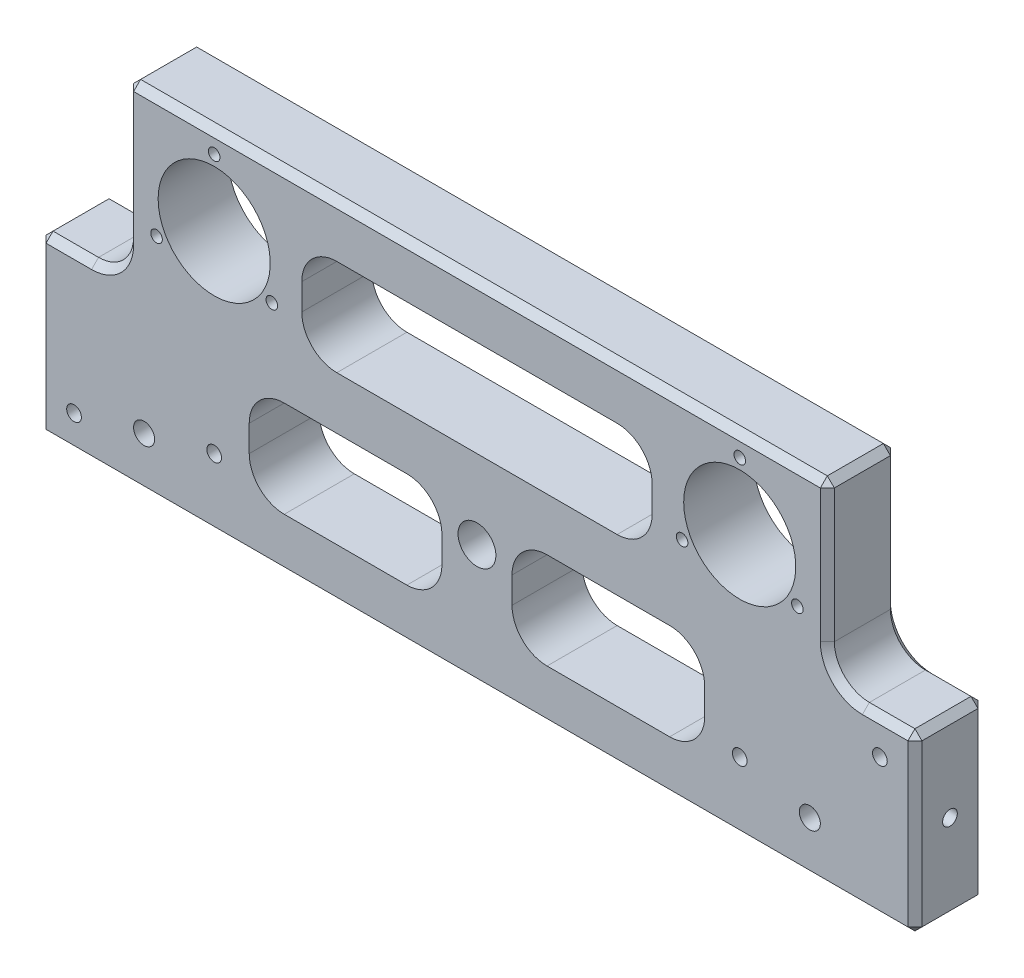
SolidWorks part; units mm, degrees
ref_plane "Plan de face" through (0, 0, 0) normal (0, 0, 1) x (1, 0, 0)
ref_plane "Plan de dessus" through (0, 0, 0) normal (0, 1, 0) x (1, 0, 0)
ref_plane "Plan de droite" through (0, 0, 0) normal (1, 0, 0) x (0, 0, -1)
ref_plane "Plan1" through (0, 0, 20) normal (0, 0, 1) x (1, 0, 0)
sketch "Esquisse1" plane through (0, 0, 20) normal (0, 0, 1) x (1, 0, 0)
  line L0 (125, 50) -> (-125, 50)
  line L1 (-125, 50) -> (-125, -50)
  line L2 (-125, -50) -> (125, -50)
  line L3 (125, -50) -> (125, 50)
extrude "Boss.-Extru.1" add sketch "Esquisse1" against normal blind 20
sketch "Esquisse2" plane through (0, 0, 0) normal (0, 0, -1) x (-1, 0, 0)
  line L0 (100, 0) -> (125, 0)
  line L1 (125, 0) -> (125, 50)
  line L2 (125, 50) -> (100, 50)
  line L3 (100, 50) -> (100, 0)
extrude "Enlèv. mat.-Extru.1" cut sketch "Esquisse2" against normal through all
sketch "Esquisse3" plane through (0, 0, 0) normal (0, 0, -1) x (-1, 0, 0)
  line L0 (-125, 0) -> (-100, 0)
  line L1 (-100, 0) -> (-100, 50)
  line L2 (-100, 50) -> (-125, 50)
  line L3 (-125, 50) -> (-125, 0)
extrude "Enlèv. mat.-Extru.2" cut sketch "Esquisse3" against normal through all
sketch "Esquisse4" plane through (0, 0, 20) normal (0, 0, 1) x (1, 0, 0)
  line L0 (50, 7.5) -> (50, 35)
  line L1 (50, 35) -> (-50, 35)
  line L2 (-50, 35) -> (-50, 7.5)
  line L3 (-50, 7.5) -> (50, 7.5)
extrude "Enlèv. mat.-Extru.3" cut sketch "Esquisse4" against normal through all
sketch "Esquisse5" plane through (0, 0, 20) normal (0, 0, 1) x (1, 0, 0)
  line L0 (-10, -35) -> (-10, -7.5)
  line L1 (-10, -7.5) -> (-65, -7.5)
  line L2 (-65, -7.5) -> (-65, -35)
  line L3 (-65, -35) -> (-10, -35)
extrude "Enlèv. mat.-Extru.4" cut sketch "Esquisse5" against normal through all
sketch "Esquisse6" plane through (0, 0, 20) normal (0, 0, 1) x (1, 0, 0)
  line L0 (10, -7.5) -> (10, -35)
  line L1 (10, -35) -> (65, -35)
  line L2 (65, -35) -> (65, -7.5)
  line L3 (65, -7.5) -> (10, -7.5)
extrude "Enlèv. mat.-Extru.5" cut sketch "Esquisse6" against normal through all
hole_wizard "Dégagement M271" positions "Esquisse8" profile "Esquisse7" hole size "M27" standard "Ansi Metric"
sketch "Esquisse8" plane through (0, 0, 0) normal (0, 0, -1) x (-1, 0, 0)
  point P0 (75, 25)
  point P1 (-75, 25)
sketch "Esquisse7" plane through (-75, 25, 0) normal (1, 0, 0) x (0, 1, 0)
  line L0 (0, 0) -> (0, 20)
  line L1 (0, 20) -> (16, 20)
  line L2 (16, 20) -> (16, 0)
  line L5 (16, 0) -> (0, 0)
  line L11 (0, -6.35) -> (0, 107.95) construction
  dimension "Diamètre du perçage jusqu'au prochain" = 32
  dimension "Profondeur du perçage jusqu'au prochain" = 20
hole_wizard "Trou taraudé M5x0.85" positions "Esquisse10" profile "Esquisse9" tap size "M5x0.8" standard "Ansi Metric"
sketch "Esquisse10" plane through (0, 0, 0) normal (0, 0, -1) x (-1, 0, 0)
  point P0 (75, -30)
  point P1 (-75, -30)
sketch "Esquisse9" plane through (-75, -30, 0) normal (1, 0, 0) x (0, 1, 0)
  line L0 (0, 0) -> (0, 20)
  line L1 (0, 20) -> (2.1, 20)
  line L2 (2.1, 20) -> (2.1, 0)
  line L5 (2.1, 0) -> (0, 0)
  line L11 (0, -6.35) -> (0, 107.95) construction
  dimension "Diamètre du trou pour taraudage jusqu'au prochain" = 4.2
  dimension "Profondeur du trou pour taraudage jusqu'au prochain" = 20
hole_wizard "Trou taraudé M12x1.251" positions "Esquisse12" profile "Esquisse11" tap size "M12x1.25" standard "Ansi Metric"
sketch "Esquisse12" plane through (0, 0, 0) normal (0, 0, -1) x (-1, 0, 0)
  point P0 (0, -15)
sketch "Esquisse11" plane through (0, -15, 0) normal (1, 0, 0) x (0, 1, 0)
  line L0 (0, 0) -> (0, 20)
  line L1 (0, 20) -> (5.4, 20)
  line L2 (5.4, 20) -> (5.4, 0)
  line L5 (5.4, 0) -> (0, 0)
  line L11 (0, -6.35) -> (0, 107.95) construction
  dimension "Diamètre du trou pour taraudage jusqu'au prochain" = 10.8
  dimension "Profondeur du trou pour taraudage jusqu'au prochain" = 20
hole_wizard "Trou taraudé M4x0.71" positions "Esquisse14" profile "Esquisse13" tap size "M4x0.7" standard "Ansi Metric"
sketch "Esquisse14" plane through (0, 0, 0) normal (0, 0, -1) x (-1, 0, 0)
  point P0 (91.4545, 15.5)
  point P1 (75, 44)
  point P2 (58.5455, 15.5)
  point P3 (-75, 44)
  point P4 (-91.4545, 15.5)
  point P5 (-58.5455, 15.5)
sketch "Esquisse13" plane through (-91.4545, 15.5, 0) normal (1, 0, 0) x (0, 1, 0)
  line L0 (0, 0) -> (0, 20)
  line L1 (0, 20) -> (1.65, 20)
  line L2 (1.65, 20) -> (1.65, 0)
  line L5 (1.65, 0) -> (0, 0)
  line L11 (0, -6.35) -> (0, 107.95) construction
  dimension "Diamètre du trou pour taraudage jusqu'au prochain" = 3.3
  dimension "Profondeur du trou pour taraudage jusqu'au prochain" = 20
hole_wizard "Trou taraudé M5x0.84" positions "Esquisse16" profile "Esquisse15" tap size "M5x0.8" standard "Ansi Metric"
sketch "Esquisse16" plane through (0, 0, 20) normal (0, 0, 1) x (1, 0, 0)
  point P0 (115, -10)
  point P1 (-115, -40)
sketch "Esquisse15" plane through (115, -10, 20) normal (1, 0, 0) x (0, -1, 0)
  line L0 (0, 0) -> (0, 20)
  line L1 (0, 20) -> (2.1, 20)
  line L2 (2.1, 20) -> (2.1, 0)
  line L5 (2.1, 0) -> (0, 0)
  line L11 (0, -6.35) -> (0, 107.95) construction
  dimension "Diamètre du trou pour taraudage jusqu'au prochain" = 4.2
  dimension "Profondeur du trou pour taraudage jusqu'au prochain" = 20
hole_wizard "Trou taraudé M5x0.83" positions "Esquisse18" profile "Esquisse17" tap size "M5x0.8" standard "Ansi Metric"
sketch "Esquisse18" plane through (-125, 0, 0) normal (-1, 0, 0) x (0, 0, 1)
  point P0 (10, -25)
sketch "Esquisse17" plane through (-125, -25, 10) normal (0, 1, 0) x (0, 0, 1)
  line L0 (0, 0) -> (0, 17.2618)
  line L1 (0, 17.2618) -> (2.1, 16)
  line L2 (2.1, 16) -> (2.1, 0)
  line L5 (2.1, 0) -> (0, 0)
  line L10 (0, 17.2618) -> (-2.1, 16) construction
  line L11 (0, -6.35) -> (0, 107.95) construction
  dimension "Diamètre du trou pour taraudage" = 4.2
  dimension "Profondeur du trou pour taraudage" = 16
  dimension "Angle de pointe" = 118
hole_wizard "Trou taraudé M5x0.81" positions "Esquisse20" profile "Esquisse19" tap size "M5x0.8" standard "Ansi Metric"
sketch "Esquisse20" plane through (0, -50, 0) normal (0, -1, 0) x (-1, 0, 0)
  point P0 (0, -10)
  point P1 (-105, -10)
  point P2 (105, -10)
sketch "Esquisse19" plane through (0, -50, 10) normal (1, 0, 0) x (0, 0, -1)
  line L0 (0, 0) -> (0, 17.2618)
  line L1 (0, 17.2618) -> (2.1, 16)
  line L2 (2.1, 16) -> (2.1, 0)
  line L5 (2.1, 0) -> (0, 0)
  line L10 (0, 17.2618) -> (-2.1, 16) construction
  line L11 (0, -6.35) -> (0, 107.95) construction
  dimension "Diamètre du trou pour taraudage" = 4.2
  dimension "Profondeur du trou pour taraudage" = 16
  dimension "Angle de pointe" = 118
hole_wizard "Trou taraudé M5x0.82" positions "Esquisse22" profile "Esquisse21" tap size "M5x0.8" standard "Ansi Metric"
sketch "Esquisse22" plane through (125, 0, 0) normal (1, 0, 0) x (0, 0, -1)
  point P0 (-10, -25)
sketch "Esquisse21" plane through (125, -25, 10) normal (0, 1, 0) x (0, 0, -1)
  line L0 (0, 0) -> (0, 17.2618)
  line L1 (0, 17.2618) -> (2.1, 16)
  line L2 (2.1, 16) -> (2.1, 0)
  line L5 (2.1, 0) -> (0, 0)
  line L10 (0, 17.2618) -> (-2.1, 16) construction
  line L11 (0, -6.35) -> (0, 107.95) construction
  dimension "Diamètre du trou pour taraudage" = 4.2
  dimension "Profondeur du trou pour taraudage" = 16
  dimension "Angle de pointe" = 118
fillet "Congé1" radius 10 14 edges at (50, 35, 10) (-10, -7.5, 10) (-65, -35, 10) (65, -35, 10) (65, -7.5, 10) (10, -7.5, 10) (50, 7.5, 10) (-65, -7.5, 10) (-10, -35, 10) (-50, 7.5, 10) (-50, 35, 10) (10, -35, 10) (-100, 0, 10) (100, 0, 10)
sketch "Esquisse27" plane through (0, 0, 20) normal (0, 0, 1) x (1, 0, 0)
  point P0 (-125, -50)
chamfer "Chanfrein1" distance 2 angle 45 26 edges at (100, 30, 0) (102.9289, 2.9289, 0) (117.5, 0, 0) (100, 50, 10) (125, -25, 0) (117.5, 0, 20) (102.9289, 2.9289, 20) (100, 30, 20) (125, 0, 10) (0, 50, 0) (0, -50, 0) (0, 50, 20) (-100, 50, 10) (125, -50, 10) (125, -25, 20) (-100, 30, 0) (-102.9289, 2.9289, 0) (-117.5, 0, 0) (-125, -25, 0) (-125, -50, 10) (-100, 30, 20) (-102.9289, 2.9289, 20) (-117.5, 0, 20) (0, -50, 20) (-125, 0, 10) (-125, -25, 20)
sketch "Esquisse23" plane through (0, 0, 20) normal (0, 0, 1) x (1, 0, 0)
  line L0 (-125, -48) -> (-125, -2) construction
  line L1 (123, -50) -> (-123, -50) construction
  line L2 (125, -2) -> (125, -48) construction
  circle A0 centre (-95, -35) radius 3
  circle A1 centre (95, -35) radius 3
  dimension "D1" = 30
  dimension "D2" = 15
  dimension "D4" = 15
  dimension "D5" = 6
  dimension "D6" = 6
  dimension "D3" = 30
extrude "Enlèv. mat.-Extru.6" cut sketch "Esquisse23" against normal through all
